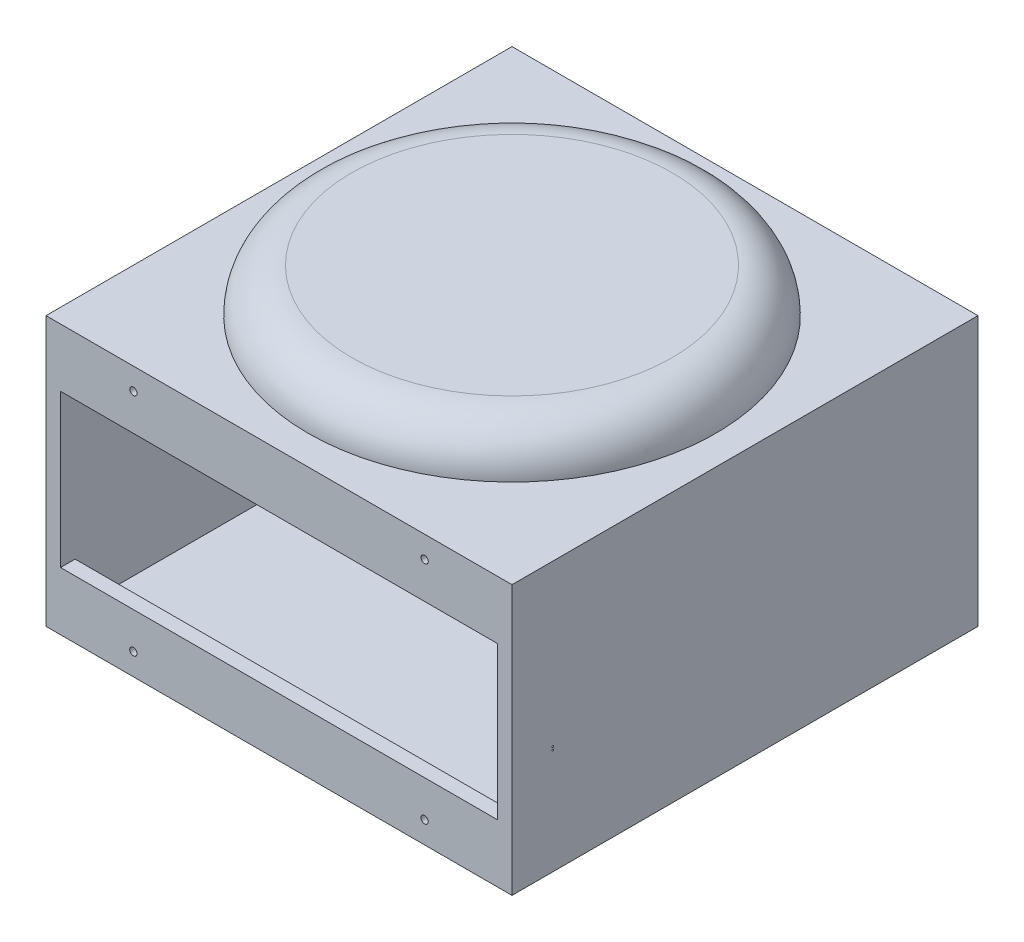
SolidWorks part; units mm, degrees
ref_plane "Front Plane" through (0, 0, 0) normal (0, 0, 1) x (1, 0, 0)
ref_plane "Top Plane" through (0, 0, 0) normal (0, 1, 0) x (1, 0, 0)
ref_plane "Right Plane" through (0, 0, 0) normal (1, 0, 0) x (0, 0, -1)
sketch "Sketch1" plane through (0, 0, 0) normal (0, 0, 1) x (1, 0, 0)
  line L1 (0, 0) -> (203.2, 0)
  line L2 (0, 0) -> (0, 117.348)
  line L3 (0, 117.348) -> (203.2, 117.348)
  line L4 (203.2, 0) -> (203.2, 117.348)
  dimension "D1" = 203.2
  dimension "D2" = 117.348
extrude "Boss-Extrude1" add sketch "Sketch1" along normal blind 203.2
sketch "Sketch2" plane through (0, 0, 203.2) normal (0, 0, 1) x (1, 0, 0)
  line L0 (203.2, 117.348) -> (0, 117.348) construction
  line L1 (6.35, 6.35) -> (196.85, 6.35)
  line L2 (6.35, 6.35) -> (6.35, 110.998)
  line L3 (6.35, 110.998) -> (196.85, 110.998)
  line L4 (196.85, 6.35) -> (196.85, 110.998)
  line L5 (203.2, 0) -> (203.2, 117.348) construction
  line L6 (0, 117.348) -> (0, 0) construction
  line L7 (0, 0) -> (203.2, 0) construction
  dimension "D1" = 6.35
  dimension "D2" = 6.35
  dimension "D3" = 6.35
  dimension "D4" = 6.35
extrude "Cut-Extrude1" cut sketch "Sketch2" against normal blind 196.85
sketch "Sketch4" plane through (0, 110.998, 0) normal (0, -1, 0) x (1, 0, 0)
  line L0 (196.85, 6.35) -> (196.85, 203.2) construction
  line L1 (6.35, 203.2) -> (196.85, 203.2)
  line L2 (6.35, 203.2) -> (6.35, 196.85)
  line L3 (6.35, 196.85) -> (196.85, 196.85)
  line L4 (196.85, 203.2) -> (196.85, 196.85)
  dimension "D1" = 6.35
extrude "Boss-Extrude3" add sketch "Sketch4" along normal blind 19.05
sketch "Sketch5" plane through (0, 6.35, 0) normal (0, 1, 0) x (1, 0, 0)
  line L0 (196.85, -6.35) -> (196.85, -203.2) construction
  line L1 (6.35, -203.2) -> (196.85, -203.2)
  line L2 (6.35, -203.2) -> (6.35, -196.85)
  line L3 (6.35, -196.85) -> (196.85, -196.85)
  line L4 (196.85, -203.2) -> (196.85, -196.85)
  dimension "D1" = 6.35
extrude "Boss-Extrude4" add sketch "Sketch5" along normal blind 19.05
sketch "Sketch6" plane through (0, 0, 203.2) normal (0, 0, 1) x (1, 0, 0)
  line L2 (196.85, 6.35) -> (196.85, 110.998) construction
  line L3 (196.85, 9.525) -> (38.1, 9.525)
  line L4 (38.1, 9.525) -> (38.1, 107.823)
  line L6 (0, 117.348) -> (0, 0) construction
  line L10 (0, 0) -> (203.2, 0) construction
  line L12 (38.1, 107.823) -> (165.1, 107.823)
  line L13 (165.1, 107.823) -> (165.1, 9.525) construction
  line L14 (203.2, 117.348) -> (0, 117.348) construction
  circle A0 centre (38.1, 107.823) radius 1.5875
  circle A1 centre (165.1, 107.823) radius 1.5875
  circle A2 centre (165.1, 9.525) radius 1.5875
  circle A3 centre (38.1, 9.525) radius 1.5875
  dimension "D5" = 3.175
  dimension "D1" = 38.1
  dimension "D2" = 127
  dimension "D3" = 9.525
  dimension "D4" = 9.525
extrude "Cut-Extrude2" cut sketch "Sketch6" against normal up to next contours A0 | A1 | A2 | A3
sketch "Sketch7" plane through (0, 117.348, 0) normal (0, 1, 0) x (1, 0, 0)
  line L0 (0, -203.2) -> (203.2, 0) construction
  circle A0 centre (101.6, -101.6) radius 88.9
  dimension "D1" = 177.8
extrude "Boss-Extrude5" add sketch "Sketch7" along normal blind 19.05
sketch "Sketch8" plane through (0, 136.398, 0) normal (0, 1, 0) x (1, 0, 0)
  circle A0 centre (101.6, -101.6) radius 88.9
  dimension "D1" = 177.8
fillet "Fillet1" radius 19.05 1 edges at (101.6, 136.398, 190.5)
sketch "Sketch9" plane through (0, 0, 0) normal (0, -1, 0) x (1, 0, 0)
  circle A0 centre (101.6, 101.6) radius 88.9
  dimension "D1" = 177.8
extrude "Boss-Extrude6" add sketch "Sketch9" along normal blind 19.05
fillet "Fillet3" radius 19.05 1 edges at (101.6, -19.05, 12.7)
sketch "Sketch10" plane through (203.2, 0, 0) normal (1, 0, 0) x (0, 0, -1)
  line L0 (-203.2, 0) -> (-203.2, 117.348) construction
  circle A0 centre (-185.42, 47.3334) radius 0.381
  circle A1 centre (-185.42, 46.0634) radius 0.381
  dimension "D1" = 0.762
  dimension "D2" = 0.762
  dimension "D3" = 1.27
  dimension "D4" = 17.78
extrude "Cut-Extrude4" cut sketch "Sketch10" against normal blind 3.81
